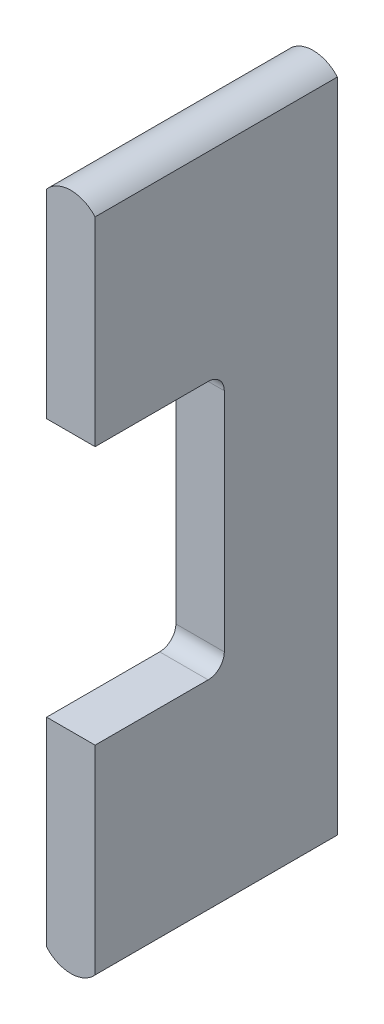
SolidWorks part; units mm, degrees
ref_plane "Face" through (0, 0, 0) normal (0, 0, 1) x (1, 0, 0)
ref_plane "Dessus" through (0, 0, 0) normal (0, 1, 0) x (1, 0, 0)
ref_plane "Droite" through (0, 0, 0) normal (1, 0, 0) x (0, 0, -1)
sketch "Esquisse1" plane through (0, 0, 0) normal (0, 0, 1) x (1, 0, 0)
  line L0 (1.5, 20.3229) -> (1.5, -20.3229)
  line L1 (-1.5, 20.3229) -> (-1.5, -20.3229)
  arc A0 (1.5, 20.3229) -> (-1.5, 20.3229) centre (0, 19) ccw
  arc A1 (-1.5, -20.3229) -> (1.5, -20.3229) centre (0, -19) ccw
  dimension "D1" = 4
  dimension "D2" = 4
  dimension "D3" = 19
  dimension "D4" = 38
  dimension "D5" = 1.5
  dimension "D6" = 3
extrude "Base-Extrusion" add sketch "Esquisse1" along normal blind 15
sketch "Esquisse2" plane through (1.5, 0, 0) normal (1, 0, 0) x (0, 0, -1)
  line L0 (-15, -20.3229) -> (-15, 20.3229) construction
  line L1 (-15, -8) -> (-15, 8)
  line L2 (-15, -8) -> (-8, -8)
  line L3 (-7, -7) -> (-7, 7)
  line L4 (-8, 8) -> (-15, 8)
  line L5 (0, -20.3229) -> (0, 20.3229) construction
  arc A0 (-7, -7) -> (-8, -8) centre (-8, -7) cw
  arc A1 (-8, 8) -> (-7, 7) centre (-8, 7) cw
  dimension "D4" = 1
  dimension "D1" = 8
  dimension "D2" = 16
  dimension "D3" = 7
extrude "Enlèv. mat.-Extru.1" cut sketch "Esquisse2" against normal through all
